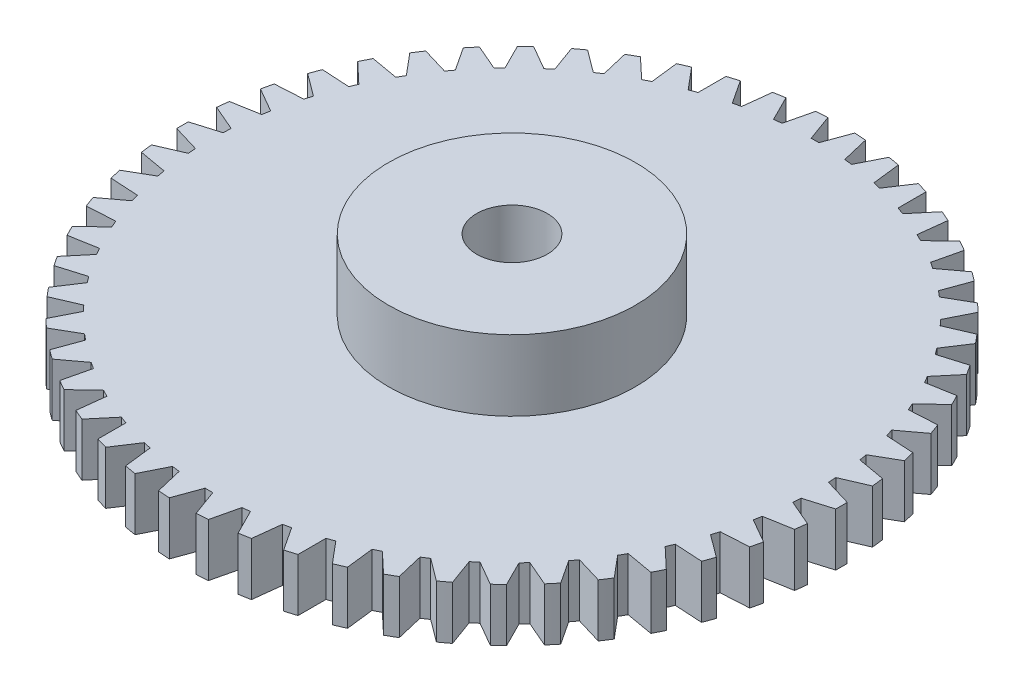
SolidWorks part; units mm, degrees
ref_plane "Front Plane" through (0, 0, 0) normal (0, 0, 1) x (1, 0, 0)
ref_plane "Top Plane" through (0, 0, 0) normal (0, 1, 0) x (1, 0, 0)
ref_plane "Right Plane" through (0, 0, 0) normal (1, 0, 0) x (0, 0, -1)
sketch "Sketch1" plane through (0, 0, 0) normal (0, 1, 0) x (1, 0, 0)
  circle A0 centre (0, 0) radius 29.6291
  dimension "D1" = 59.2582
extrude "Extrude1" add sketch "Sketch1" against normal blind 4.7625
ref_axis "Axis1" through (0, -50.273, 0) along (0, 1, 0)
sketch "Sketch2" plane through (0, 0, 0) normal (0, 1, 0) x (1, 0, 0)
  line L0 (0, 0) -> (0, 29.6291) construction
  line L1 (-0.3471, 27.2466) -> (0.3471, 27.2466)
  line L2 (0.3471, 27.2466) -> (1.2053, 29.6046)
  line L3 (-0.3471, 27.2466) -> (-1.2053, 29.6046)
  line L4 (-0.8306, 28.575) -> (0.8306, 28.575) construction
  circle A0 centre (0, 0) radius 29.6291 construction
  point P8 (0, 27.2466)
  dimension "D1" = 2.3825
  dimension "D2" = 110
  dimension "D3" = 110
  dimension "D4" = 28.575
  dimension "D5" = 1.6612
extrude "Extrude2" cut sketch "Sketch2" against normal through all and the other way through all flip side to cut
pattern_circular "CirPattern1" count 54 over 360 about axis through (0, -50.273, 0) along (0, 1, 0) of "Extrude2"
sketch "Sketch3" plane through (0, 0, 0) normal (0, 1, 0) x (1, 0, 0)
  circle A0 centre (0, 0) radius 11.1125
  dimension "D1" = 22.225
extrude "Extrude3" add sketch "Sketch3" along normal blind 6.35
sketch "Sketch4" plane through (0, 6.35, 0) normal (0, 1, 0) x (1, 0, 0)
  circle A0 centre (0, 0) radius 3.175
  dimension "D1" = 6.35
extrude "Extrude4" cut sketch "Sketch4" against normal through all
